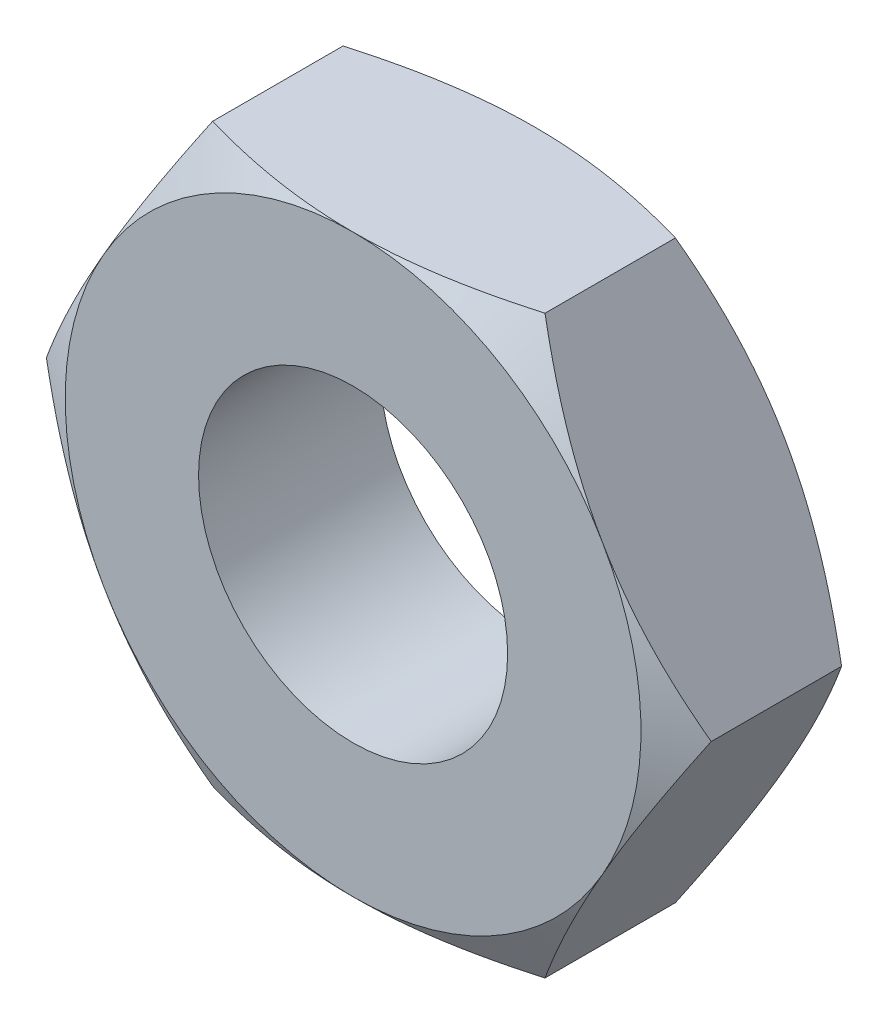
SolidWorks part; units mm, degrees
ref_plane "Front Plane" through (0, 0, 0) normal (0, 0, 1) x (1, 0, 0)
ref_plane "Top Plane" through (0, 0, 0) normal (0, 1, 0) x (1, 0, 0)
ref_plane "Right Plane" through (0, 0, 0) normal (1, 0, 0) x (0, 0, -1)
sketch "Sketch1" plane through (0, 0, 0) normal (0, 0, 1) x (1, 0, 0)
  line L1 (5.4848, -9.5) -> (10.9697, 0)
  line L2 (10.9697, 0) -> (5.4848, 9.5)
  line L3 (5.4848, 9.5) -> (-5.4848, 9.5)
  line L4 (-5.4848, 9.5) -> (-10.9697, 0)
  line L5 (-10.9697, 0) -> (-5.4848, -9.5)
  line L6 (-5.4848, -9.5) -> (5.4848, -9.5)
  circle A0 centre (0, 0) radius 9.5 construction
  dimension "D1" = 19
extrude "Extrude1" add sketch "Sketch1" along normal blind 6
hole_wizard " Tapped Hole1" positions "Sketch3" profile "Sketch2" tap size "M12" standard "DIN"
sketch "Sketch3" plane through (0, 0, 6) normal (0, 0, 1) x (1, 0, 0)
  point P0 (0, 0)
sketch "Sketch2" plane through (0, 0, 6) normal (1, 0, 0) x (0, -1, 0)
  line L0 (0, 0) -> (0, 6)
  line L1 (0, 6) -> (5.1, 6)
  line L2 (5.1, 6) -> (5.1, 0)
  line L5 (5.1, 0) -> (0, 0)
  line L11 (0, -6.35) -> (0, 107.95) construction
  dimension "Thru Tap Drill Dia." = 10.2
  dimension "Thru Tap Drill Depth" = 6
sketch "Sketch4" plane through (0, 0, 0) normal (0, 1, 0) x (1, 0, 0)
  line L0 (-10.9697, -5.1515) -> (-9.5, -6)
  line L1 (-10.9697, -6) -> (-10.9697, 0) construction
  line L2 (-5.4848, -6) -> (-10.9697, -6) construction
  line L3 (-10.9697, -6) -> (-10.9697, -5.1515)
  line L4 (-9.5, -6) -> (-10.9697, -6)
  line L5 (-10.9697, -3) -> (10.9697, -3) construction
  line L6 (10.9697, -6) -> (10.9697, 0) construction
  line L7 (-10.9697, -0.8485) -> (-9.5, 0)
  line L8 (-10.9697, 0) -> (-10.9697, -0.8485)
  line L9 (-9.5, 0) -> (-10.9697, 0)
  line L10 (0, 0) -> (0, -6) construction
  line L11 (5.4848, -6) -> (-5.4848, -6) construction
  dimension "D1" = 30
  dimension "D2" = 9.5
revolve "Cut-Revolve1" cut sketch "Sketch4" angle 360 about L10
